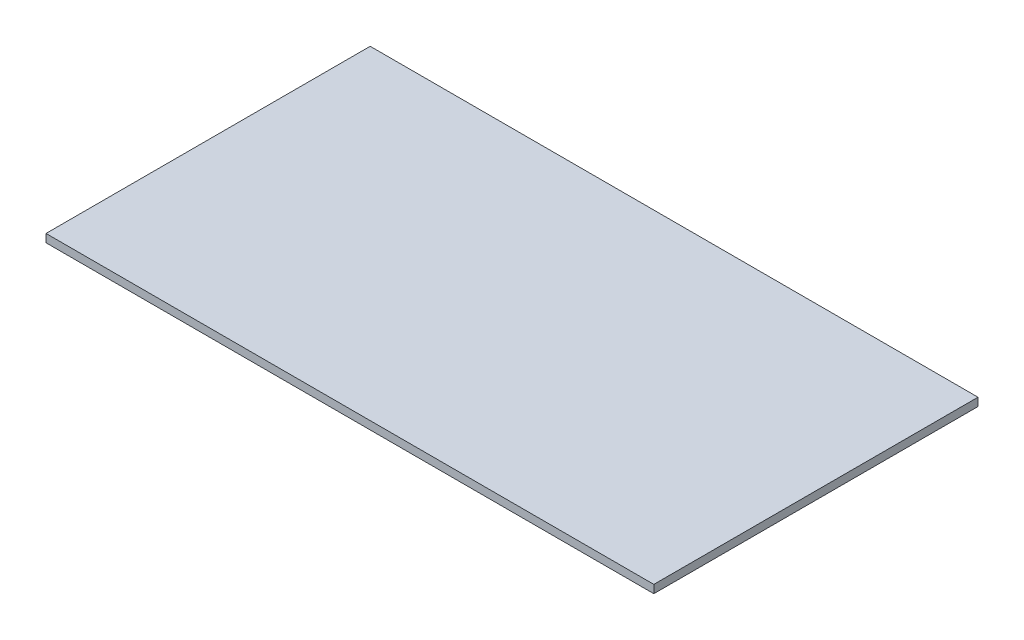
SolidWorks part; units mm, degrees
ref_plane "Спереди" through (0, 0, 0) normal (0, 0, 1) x (1, 0, 0)
ref_plane "Сверху" through (0, 0, 0) normal (0, 1, 0) x (1, 0, 0)
ref_plane "Справа" through (0, 0, 0) normal (1, 0, 0) x (0, 0, -1)
sketch "Эскиз1" plane through (0, 0, 0) normal (0, 1, 0) x (1, 0, 0)
  line L1 (-75, -40) -> (75, -40)
  line L2 (-75, -40) -> (-75, 40)
  line L3 (-75, 40) -> (75, 40)
  line L4 (75, -40) -> (75, 40)
  line L5 (-75, -40) -> (75, 40) construction
  line L6 (-75, 40) -> (75, -40) construction
  point P0 (0, 0)
  dimension "D1" = 150
  dimension "D2" = 80
extrude "Бобышка-Вытянуть1" add sketch "Эскиз1" along normal blind 2
